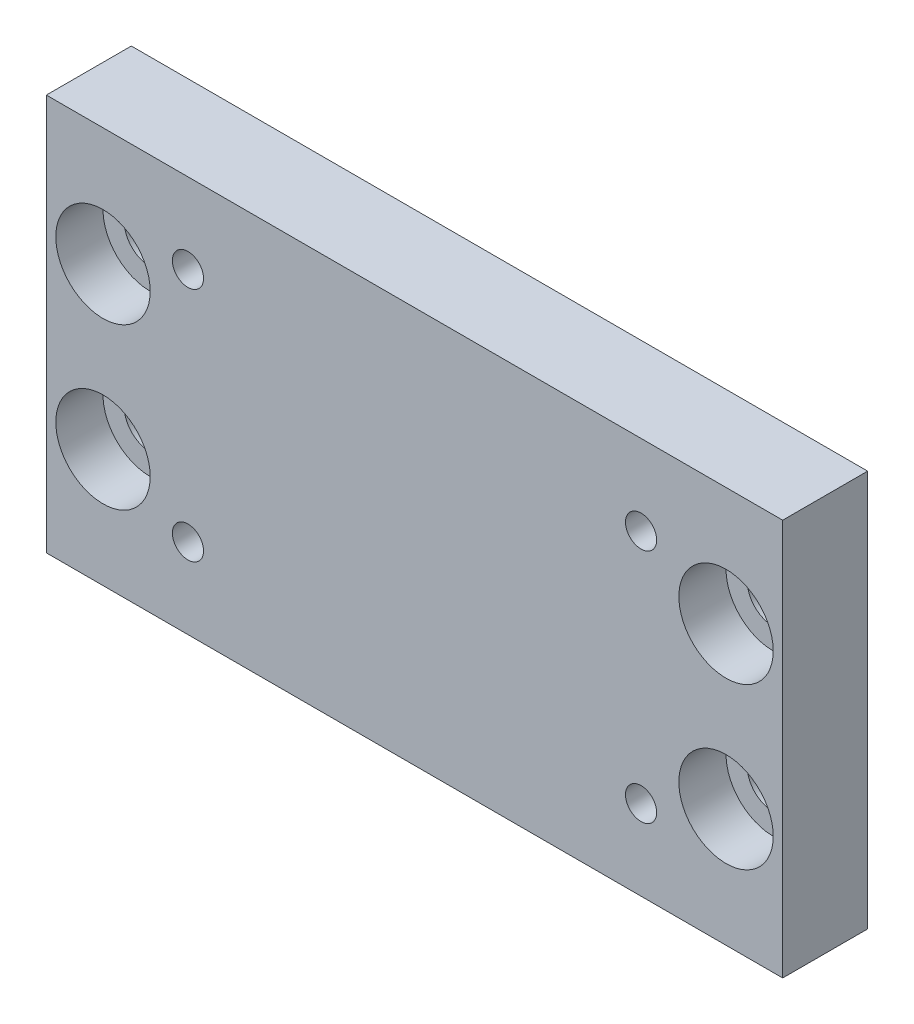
SolidWorks part; units mm, degrees
ref_plane "Face" through (0, 0, 0) normal (0, 0, 1) x (1, 0, 0)
ref_plane "Dessus" through (0, 0, 0) normal (0, 1, 0) x (1, 0, 0)
ref_plane "Droite" through (0, 0, 0) normal (1, 0, 0) x (0, 0, -1)
sketch "Esquisse1" plane through (0, 0, 0) normal (0, 0, 1) x (1, 0, 0)
  line L0 (-19.0147, 0) -> (37.2533, 0) construction
  line L1 (-39, 21) -> (39, 21)
  line L2 (-39, 21) -> (-39, -21)
  line L3 (-39, -21) -> (39, -21)
  line L4 (39, 21) -> (39, -21)
  line L5 (0, 17.6565) -> (0, -13.776) construction
  dimension "D1" = 78
  dimension "D2" = 42
extrude "Extrusion1" add sketch "Esquisse1" along normal blind 9
hole_wizard "Trou taraudé M4x0.71" positions "Esquisse5" profile "Esquisse4" tap size "M4x0.7" standard "ISO"
sketch "Esquisse5" plane through (0, 0, 9) normal (0, 0, 1) x (1, 0, 0)
  line L0 (-3.9992, 0) -> (8.9958, 0) construction
  line L2 (0, 5.8541) -> (0, -5.2516) construction
  point P0 (-24, 12.5)
  point P1 (24, 12.5)
  point P2 (24, -12.5)
  point P3 (-24, -12.5)
  dimension "D1" = 48
  dimension "D2" = 25
sketch "Esquisse4" plane through (-24, 12.5, 9) normal (1, 0, 0) x (0, -1, 0)
  line L0 (0, 0) -> (0, 12.4914)
  line L1 (0, 12.4914) -> (1.65, 11.5)
  line L2 (1.65, 11.5) -> (1.65, 0)
  line L5 (1.65, 0) -> (0, 0)
  line L10 (0, 12.4914) -> (-1.65, 11.5) construction
  line L11 (0, -6.35) -> (0, 107.95) construction
  dimension "Diamètre du trou pour taraudage" = 3.3
  dimension "Profondeur du trou pour taraudage" = 11.5
  dimension "Angle de pointe" = 118
hole_wizard "Chambrage pour vis à tête hexagonale M51" positions "Esquisse7" profile "Esquisse6" counterbore size "M5" standard "ISO"
sketch "Esquisse7" plane through (0, 0, 9) normal (0, 0, 1) x (1, 0, 0)
  line L0 (5.603, 0) -> (-8.9763, 0) construction
  line L1 (0, 6.2691) -> (0, -4.3076) construction
  point P0 (-33, 8.5)
  point P1 (-33, -8.5)
  point P2 (33, -8.5)
  point P3 (33, 8.5)
  dimension "D1" = 66
  dimension "D2" = 17
sketch "Esquisse6" plane through (-33, 8.5, 9) normal (1, 0, 0) x (0, -1, 0)
  line L0 (0, 0) -> (0, 9)
  line L1 (0, 9) -> (2.75, 9)
  line L3 (2.75, 9) -> (2.75, 5)
  line L4 (2.75, 5) -> (5, 5)
  line L5 (5, 5) -> (5, 0)
  line L7 (5, 0) -> (0, 0)
  line L11 (0, -6.35) -> (0, 107.95) construction
  dimension "Diamètre du perçage jusqu'au prochain" = 5.5
  dimension "Profondeur du perçage jusqu'au prochain" = 9
  dimension "Diamètre du chambrage" = 10
  dimension "Profondeur du chambrage" = 5
